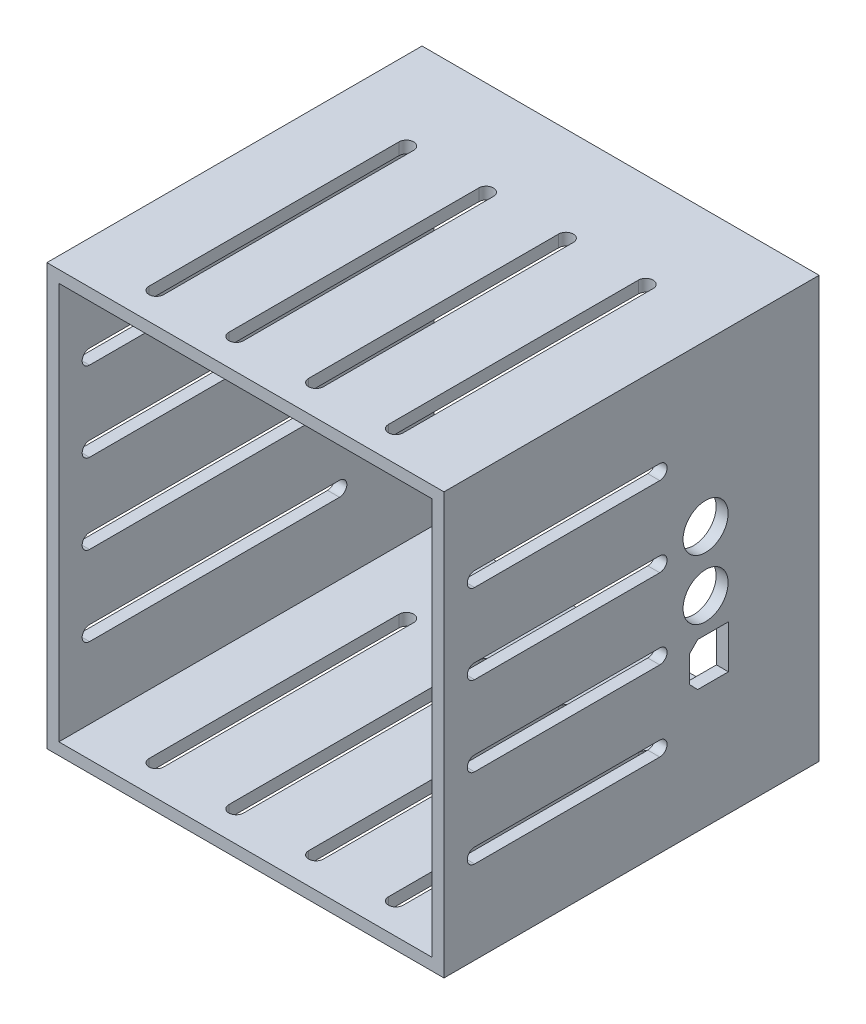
SolidWorks part; units mm, degrees
ref_plane "Front Plane" through (0, 0, 0) normal (0, 0, 1) x (1, 0, 0)
ref_plane "Top Plane" through (0, 0, 0) normal (0, 1, 0) x (1, 0, 0)
ref_plane "Right Plane" through (0, 0, 0) normal (1, 0, 0) x (0, 0, -1)
sketch "Sketch1" plane through (0, 0, -9133.0074) normal (0, 0, 1) x (1, 0, 0)
  line L0 (46.75, 79.75) -> (46.75, -25.75) construction
  line L1 (-52.75, 79.75) -> (46.75, 79.75)
  line L2 (-52.75, 79.75) -> (-52.75, -25.75)
  line L3 (-52.75, -25.75) -> (46.75, -25.75)
  line L4 (46.75, 79.75) -> (46.75, -25.75)
  line L5 (-49.75, 76.75) -> (43.75, 76.75)
  line L6 (-49.75, 76.75) -> (-49.75, -22.75)
  line L7 (-49.75, -22.75) -> (43.75, -22.75)
  line L8 (43.75, 76.75) -> (43.75, -22.75)
  line L9 (-49.75, 76.75) -> (-49.75, 79.75) construction
  line L10 (-49.75, 79.75) -> (-52.75, 76.75) construction
  line L11 (-52.75, 76.75) -> (-49.75, 76.75) construction
  line L12 (43.75, -22.75) -> (46.75, -22.75) construction
  line L13 (43.75, -22.75) -> (43.75, -25.75) construction
  line L14 (43.75, -25.75) -> (46.75, -22.75) construction
  dimension "D1" = 3
extrude "Walls" add sketch "Sketch1" along normal blind 94
sketch "Sketch2" plane through (46.75, 0, 0) normal (1, 0, 0) x (0, 0, -1)
  line L0 (9117.0074, -25.75) -> (9117.0074, 79.75) construction
  line L1 (9039.0074, -25.75) -> (9133.0074, -25.75) construction
  line L2 (9039.0074, 79.75) -> (9133.0074, 79.75) construction
  line L3 (9133.0074, -15.865) -> (3269.2401, -15.865) construction
  line L6 (9133.0074, 73) -> (9133.0074, -19) construction
  line L7 (9110.2806, 5.0625) -> (9110.2806, 15.9125)
  line L8 (9110.2806, 15.9125) -> (9102.5806, 15.9125)
  line L9 (9102.5806, 15.9125) -> (9100.5306, 13.8125)
  line L10 (9100.5306, 13.8125) -> (9100.5306, 7.1625)
  line L11 (9100.5306, 7.1625) -> (9102.5806, 5.0625)
  line L12 (9102.5806, 5.0625) -> (9110.2806, 5.0625)
  line L14 (9133.0074, -14.025) -> (9133.0074, -17.705) construction
  line L15 (9104.5604, 24.4575) -> (9117.0074, 24.4575) construction
  line L16 (9104.5604, 39.4575) -> (9117.0074, 39.4575) construction
  circle A0 centre (9104.5604, 24.4575) radius 5.6475
  circle A1 centre (9104.5604, 39.4575) radius 5.6475
  point P8 (9133.0074, -15.865)
  point P9 (9106.4306, 5.0625)
  point P25 (9110.2806, 10.4875)
  dimension "D6" = 11.295
  dimension "D1" = 16
  dimension "D2" = 9.75
  dimension "D3" = 10.85
  dimension "D4" = 6.65
  dimension "D5" = 7.7
  dimension "D7" = 10.5768
  dimension "D8" = 26.3525
  dimension "D9" = 12.447
  dimension "D10" = 13.97
  dimension "D11" = 15
extrude "Ports" cut sketch "Sketch2" against normal up to next
sketch "Sketch3" plane through (0, -25.75, 0) normal (0, -1, 0) x (1, 0, 0)
  line L0 (-52.75, -9086.0074) -> (46.75, -9086.0074) construction
  line L1 (-52.75, -9039.0074) -> (-52.75, -9133.0074) construction
  line L2 (46.75, -9039.0074) -> (46.75, -9133.0074) construction
  line L3 (-3, -9039.0074) -> (-3, -9133.0074) construction
  line L4 (-52.75, -9039.0074) -> (46.75, -9039.0074) construction
  line L5 (-52.75, -9133.0074) -> (46.75, -9133.0074) construction
  line L6 (-33, -9046.6874) -> (-33, -9109.3274) construction
  line L7 (-13, -9109.3274) -> (-13, -9046.6874) construction
  line L8 (7, -9046.6874) -> (7, -9109.3274) construction
  line L9 (27, -9109.3274) -> (27, -9046.6874) construction
  line L10 (-52.75, -9117.0074) -> (46.75, -9117.0074) construction
  line L11 (-33, -9078.0074) -> (27, -9078.0074) construction
  line L12 (-34.84, -9046.6874) -> (-34.84, -9109.3274)
  line L13 (-31.16, -9109.3274) -> (-31.16, -9046.6874)
  line L14 (-14.84, -9046.6874) -> (-14.84, -9109.3274)
  line L15 (-11.16, -9109.3274) -> (-11.16, -9046.6874)
  line L16 (5.16, -9046.6874) -> (5.16, -9109.3274)
  line L17 (8.84, -9109.3274) -> (8.84, -9046.6874)
  line L18 (25.16, -9046.6874) -> (25.16, -9109.3274)
  line L19 (28.84, -9109.3274) -> (28.84, -9046.6874)
  arc A0 (-31.16, -9046.6874) -> (-34.84, -9046.6874) centre (-33, -9046.6874) ccw
  arc A1 (-14.84, -9046.6874) -> (-11.16, -9046.6874) centre (-13, -9046.6874) cw
  arc A2 (5.16, -9046.6874) -> (8.84, -9046.6874) centre (7, -9046.6874) cw
  arc A3 (25.16, -9046.6874) -> (28.84, -9046.6874) centre (27, -9046.6874) cw
  arc A4 (-31.16, -9109.3274) -> (-34.84, -9109.3274) centre (-33, -9109.3274) cw
  arc A5 (-11.16, -9109.3274) -> (-14.84, -9109.3274) centre (-13, -9109.3274) cw
  arc A6 (8.84, -9109.3274) -> (5.16, -9109.3274) centre (7, -9109.3274) cw
  arc A7 (25.16, -9109.3274) -> (28.84, -9109.3274) centre (27, -9109.3274) ccw
  point P24 (-3, -9078.0074)
  dimension "D2" = 7.68
  dimension "D1" = 16
  dimension "D3" = 7.68
  dimension "D4" = 20
  dimension "D5" = 20
  dimension "D6" = 20
  dimension "D7" = 3.68
extrude "Rails Cut 1" cut sketch "Sketch3" against normal through all
sketch "Sketch4" plane through (-52.75, 0, 0) normal (-1, 0, 0) x (0, 0, 1)
  line L0 (-9117.0074, -25.75) -> (-9117.0074, 79.75) construction
  line L1 (-9039.0074, -25.75) -> (-9133.0074, -25.75) construction
  line L2 (-9039.0074, 79.75) -> (-9133.0074, 79.75) construction
  line L3 (-9039.0074, 27) -> (-9133.0074, 27) construction
  line L4 (-9039.0074, 79.75) -> (-9039.0074, -25.75) construction
  line L5 (-9086.0074, -25.75) -> (-9086.0074, 79.75) construction
  line L6 (-9039.0074, -25.75) -> (-9133.0074, -25.75) construction
  line L7 (-9078.0074, 79.75) -> (-9078.0074, -25.75) construction
  line L8 (-9046.6874, 57) -> (-9109.3274, 57) construction
  line L9 (-9109.3274, 37) -> (-9046.6874, 37) construction
  line L10 (-9046.6874, 17) -> (-9109.3274, 17) construction
  line L11 (-9109.3274, -3) -> (-9046.6874, -3) construction
  line L12 (-9109.3274, -25.75) -> (-9046.6874, -25.75) construction
  line L13 (-9046.6874, 58.84) -> (-9109.3274, 58.84)
  line L14 (-9109.3274, 55.16) -> (-9046.6874, 55.16)
  line L15 (-9046.6874, 38.84) -> (-9109.3274, 38.84)
  line L17 (-9109.3274, 35.16) -> (-9046.6874, 35.16)
  line L18 (-9046.6874, 18.84) -> (-9109.3274, 18.84)
  line L19 (-9109.3274, 15.16) -> (-9046.6874, 15.16)
  line L20 (-9046.6874, -1.16) -> (-9109.3274, -1.16)
  line L21 (-9109.3274, -4.84) -> (-9046.6874, -4.84)
  arc A0 (-9046.6874, 55.16) -> (-9046.6874, 58.84) centre (-9046.6874, 57) ccw
  arc A1 (-9046.6874, 38.84) -> (-9046.6874, 35.16) centre (-9046.6874, 37) cw
  arc A2 (-9046.6874, 18.84) -> (-9046.6874, 15.16) centre (-9046.6874, 17) cw
  arc A3 (-9046.6874, -1.16) -> (-9046.6874, -4.84) centre (-9046.6874, -3) cw
  arc A4 (-9109.3274, 55.16) -> (-9109.3274, 58.84) centre (-9109.3274, 57) cw
  arc A5 (-9109.3274, 38.84) -> (-9109.3274, 35.16) centre (-9109.3274, 37) ccw
  arc A6 (-9109.3274, 18.84) -> (-9109.3274, 15.16) centre (-9109.3274, 17) ccw
  arc A7 (-9109.3274, -1.16) -> (-9109.3274, -4.84) centre (-9109.3274, -3) ccw
  point P28 (-9078.0074, 57)
  dimension "D5" = 7.68
  dimension "D6" = 7.68
  dimension "D7" = 3.68
  dimension "D1" = 20
  dimension "D2" = 20
  dimension "D3" = 20
  dimension "D4" = 10
extrude "Rails Cut 2" cut sketch "Sketch4" against normal up to next
sketch "Sketch5" plane through (46.75, 0, 0) normal (1, 0, 0) x (0, 0, -1)
  line L0 (9046.6874, -4.84) -> (9093.0729, -4.84)
  line L1 (9109.3274, -4.84) -> (9046.6874, -4.84) construction
  line L2 (9046.6874, -1.16) -> (9109.3274, -1.16) construction
  line L3 (9093.0729, -1.16) -> (9046.6874, -1.16)
  line L4 (9046.6874, 15.16) -> (9093.0729, 15.16)
  line L5 (9109.3274, 15.16) -> (9046.6874, 15.16) construction
  line L6 (9046.6874, 18.84) -> (9109.3274, 18.84) construction
  line L7 (9093.0729, 18.84) -> (9046.6874, 18.84)
  line L8 (9046.6874, 35.16) -> (9093.0729, 35.16)
  line L9 (9109.3274, 35.16) -> (9046.6874, 35.16) construction
  line L10 (9046.6874, 38.84) -> (9109.3274, 38.84) construction
  line L11 (9093.0729, 38.84) -> (9046.6874, 38.84)
  line L12 (9046.6874, 55.16) -> (9093.0729, 55.16)
  line L13 (9109.3274, 55.16) -> (9046.6874, 55.16) construction
  line L14 (9046.6874, 58.84) -> (9109.3274, 58.84) construction
  line L15 (9093.0729, 58.84) -> (9046.6874, 58.84)
  line L16 (9098.9129, -25.75) -> (9098.9129, 79.75) construction
  line L17 (9039.0074, -25.75) -> (9133.0074, -25.75) construction
  line L18 (9039.0074, 79.75) -> (9133.0074, 79.75) construction
  line L19 (9094.9129, 79.75) -> (9094.9129, -25.75) construction
  arc A0 (9093.0729, -4.84) -> (9093.0729, -1.16) centre (9093.0729, -3) ccw
  arc A1 (9046.6874, -1.16) -> (9046.6874, -4.84) centre (9046.6874, -3) ccw
  arc A2 (9093.0729, 15.16) -> (9093.0729, 18.84) centre (9093.0729, 17) ccw
  arc A3 (9046.6874, 18.84) -> (9046.6874, 15.16) centre (9046.6874, 17) ccw
  arc A4 (9093.0729, 35.16) -> (9093.0729, 38.84) centre (9093.0729, 37) ccw
  arc A5 (9046.6874, 38.84) -> (9046.6874, 35.16) centre (9046.6874, 37) ccw
  arc A6 (9093.0729, 55.16) -> (9093.0729, 58.84) centre (9093.0729, 57) ccw
  arc A7 (9046.6874, 58.84) -> (9046.6874, 55.16) centre (9046.6874, 57) ccw
  circle A9 centre (9104.5604, 24.4575) radius 5.6475 construction
  dimension "D1" = 4
extrude "Rails Cut 3" cut sketch "Sketch5" against normal up to next
